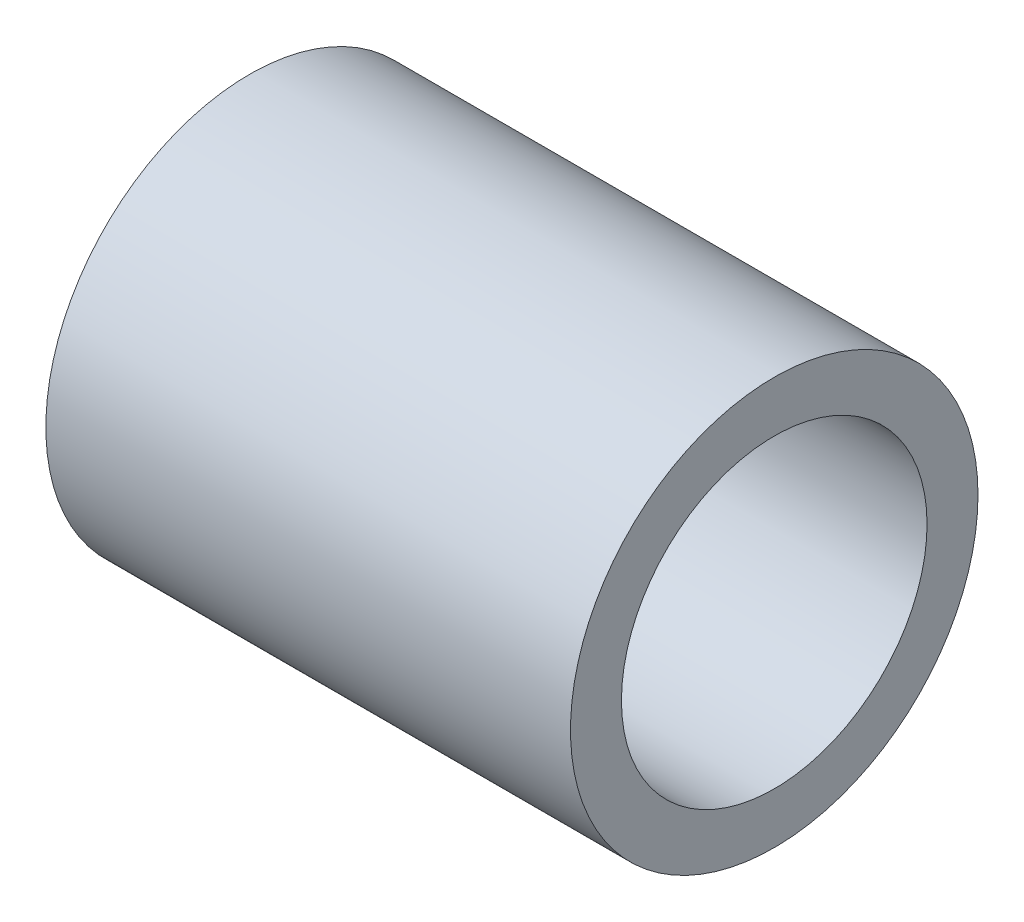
SolidWorks part; units mm, degrees
ref_plane "Face" through (0, 0, 0) normal (0, 0, 1) x (1, 0, 0)
ref_plane "Dessus" through (0, 0, 0) normal (0, 1, 0) x (1, 0, 0)
ref_plane "Droite" through (0, 0, 0) normal (1, 0, 0) x (0, 0, -1)
sketch "Esquisse1" plane through (0, 0, 0) normal (0, 0, 1) x (1, 0, 0)
  line L0 (-20, 26) -> (-20, 25.5)
  line L1 (-20, 25.5) -> (-19.5, 25)
  line L2 (-19.5, 25) -> (-9.7, 25)
  line L3 (-9.7, 25) -> (-9.7, 26)
  line L4 (-9.7, 26) -> (-20, 26)
  line L5 (-20, 22) -> (-9.7, 22) construction
revolve "Base-Révolution" add sketch "Esquisse1" angle 360 about L5
